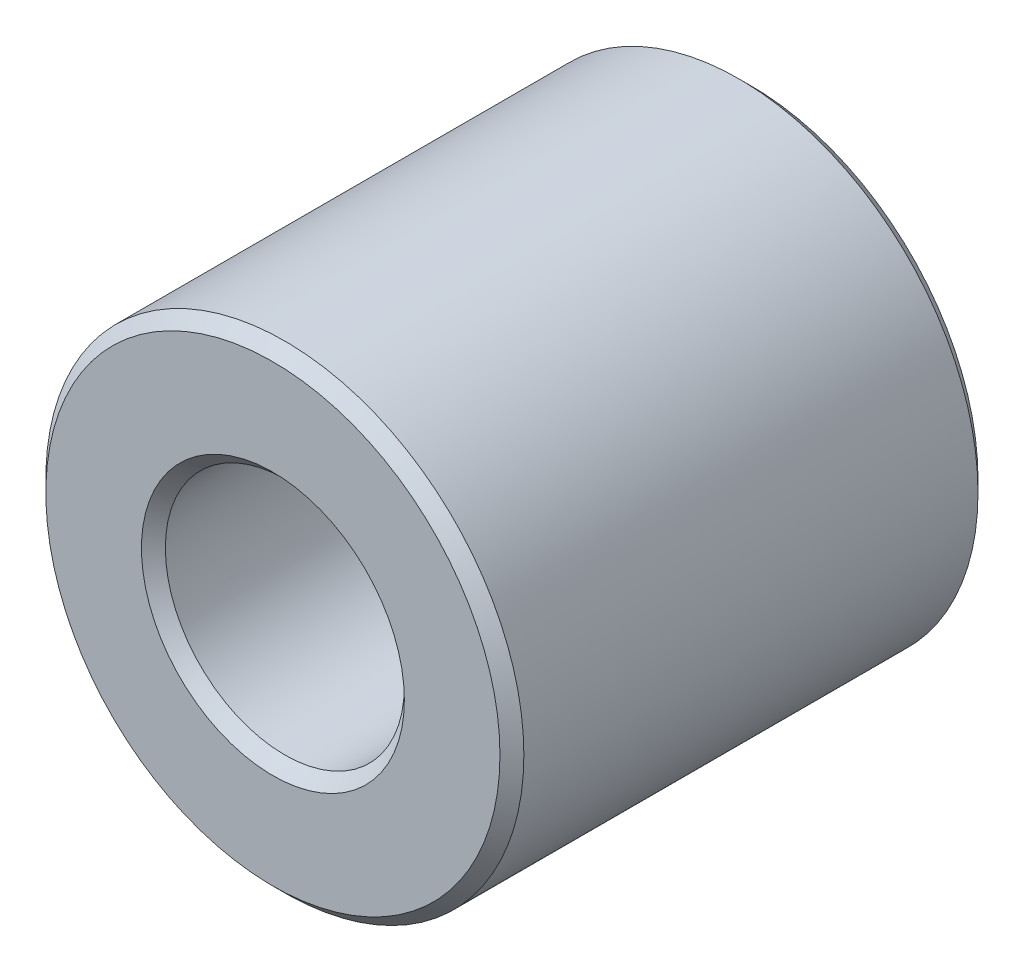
SolidWorks part; units mm, degrees
ref_plane "Front Plane" through (0, 0, 0) normal (0, 0, 1) x (1, 0, 0)
ref_plane "Top Plane" through (0, 0, 0) normal (0, 1, 0) x (1, 0, 0)
ref_plane "Right Plane" through (0, 0, 0) normal (1, 0, 0) x (0, 0, -1)
sketch "Sketch1" plane through (0, 0, 0) normal (0, 0, 1) x (1, 0, 0)
  circle A0 centre (0, 0) radius 20
  circle A1 centre (0, 0) radius 40
  dimension "D1" = 40
  dimension "D2" = 80
extrude "Boss-Extrude1" add sketch "Sketch1" along normal mid plane 80
chamfer "Chamfer1" distance 2 angle 45 4 edges at (20, 0, -40) (40, 0, -40) (20, 0, 40) (40, 0, 40)
